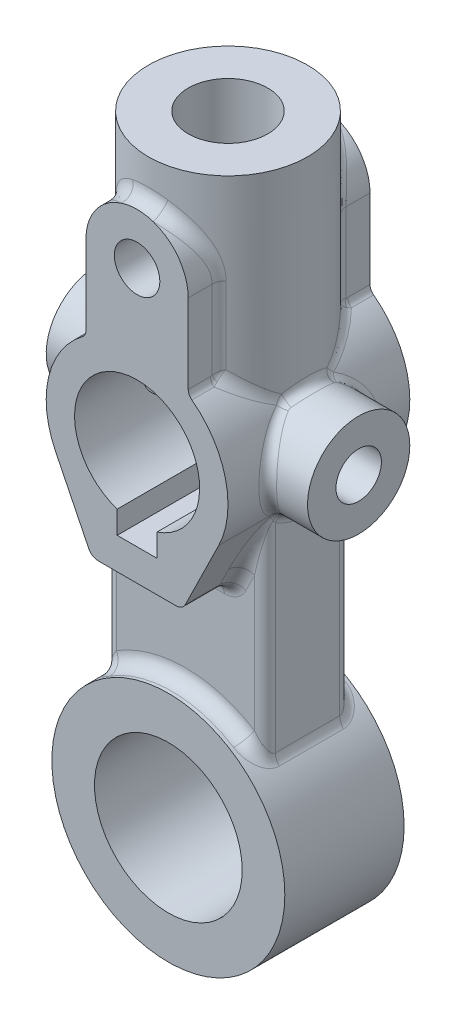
SolidWorks part; units mm, degrees
ref_plane "Front" through (0, 0, 0) normal (0, 0, 1) x (1, 0, 0)
ref_plane "Top" through (0, 0, 0) normal (0, 1, 0) x (1, 0, 0)
ref_plane "Right" through (0, 0, 0) normal (1, 0, 0) x (0, 0, -1)
sketch "Sketch1" plane through (0, 0, 0) normal (0, 0, 1) x (1, 0, 0)
  line L0 (0, 0) -> (0, 44.45) construction
  line L1 (14.2875, 21.0007) -> (14.2875, 44.45)
  line L2 (-14.2875, 21.0007) -> (-14.2875, 44.45)
  line L3 (-12.7, -31.75) -> (12.7, -31.75)
  line L4 (12.7, -31.75) -> (22.7967, -11.2013)
  line L5 (-12.7, -31.75) -> (-22.7967, -11.2013)
  line L6 (0, 0) -> (0, -31.75) construction
  arc A0 (22.7967, -11.2013) -> (14.2875, 21.0007) centre (0, 0) ccw
  arc A1 (-14.2875, 44.45) -> (14.2875, 44.45) centre (0, 44.45) cw
  arc A2 (-14.2875, 21.0007) -> (-22.7967, -11.2013) centre (0, 0) ccw
  dimension "D1" = 14.2875
  dimension "D2" = 44.45
  dimension "D3" = 50.8
  dimension "D4" = 31.75
  dimension "D5" = 25.4
extrude "Base-Extrude" add sketch "Sketch1" along normal mid plane 50.8
sketch "Sketch2" plane through (0, 0, 0) normal (0, 1, 0) x (1, 0, 0)
  circle A0 centre (0, 0) radius 22.225
  dimension "D1" = 44.45
extrude "Boss-Extrude1" add sketch "Sketch2" along normal blind 69.85
sketch "Sketch3" plane through (0, 0, 0) normal (0, 1, 0) x (1, 0, 0)
  line L0 (0, 0) -> (22.225, 0) construction
  line L1 (-22.225, 11.9062) -> (22.225, 11.9062)
  line L2 (-22.225, 11.9062) -> (-22.225, -11.9062)
  line L3 (-22.225, -11.9062) -> (22.225, -11.9062)
  line L4 (22.225, 11.9062) -> (22.225, -11.9062)
  circle A0 centre (0, 0) radius 22.225 construction
  dimension "D1" = 23.8125
extrude "Boss-Extrude2" add sketch "Sketch3" against normal blind 95.25
sketch "Sketch4" plane through (0, 0, 0) normal (0, 0, 1) x (1, 0, 0)
  line L0 (0, 69.85) -> (0, 21.0007) construction
  line L1 (-22.225, -95.25) -> (22.225, -95.25) construction
  circle A0 centre (0, -95.25) radius 32.5437
  dimension "D1" = 65.0875
extrude "Boss-Extrude3" add sketch "Sketch4" along normal mid plane 33.3375
sketch "Sketch5" plane through (0, 0, 0) normal (1, 0, 0) x (0, 0, -1)
  circle A0 centre (0, 0) radius 14.2875
  dimension "D1" = 28.575
extrude "Boss-Extrude4" add sketch "Sketch5" along normal mid plane 73.025
sketch "Sketch7" plane through (0, 0, 0) normal (0, 0, 1) x (1, 0, 0)
  line L0 (0, 0) -> (0, -22.9184) construction
  line L1 (0, 69.85) -> (0, 13.3293) construction
  line L2 (-5.5563, -22.9184) -> (5.5562, -22.9184)
  line L3 (5.5562, -22.9184) -> (5.5562, -16.5684)
  line L4 (-5.5563, -22.9184) -> (-5.5563, -16.5684)
  arc A0 (5.5562, -16.5684) -> (-5.5563, -16.5684) centre (0, 0) ccw
  dimension "D1" = 34.9504
  dimension "D2" = 11.1125
  dimension "D3" = 6.35
extrude "Cut-Extrude2" cut sketch "Sketch7" against normal through all and the other way through all
sketch "Sketch10" plane through (0, 0, 0) normal (0, 0, 1) x (1, 0, 0)
  line L0 (0, 69.85) -> (0, 13.3293) construction
  circle A0 centre (0, 44.45) radius 6.35
  arc A1 (14.2875, 44.45) -> (-14.2875, 44.45) centre (0, 44.45) ccw construction
  dimension "D1" = 12.7
extrude "Cut-Extrude5" cut sketch "Sketch10" against normal through all and the other way through all
sketch "Sketch6" plane through (0, 0, 0) normal (1, 0, 0) x (0, 0, -1)
  circle A0 centre (0, 0) radius 6.35
  dimension "D1" = 12.7
extrude "Cut-Extrude1" cut sketch "Sketch6" against normal through all and the other way through all
sketch "Sketch8" plane through (0, 69.85, 0) normal (0, 1, 0) x (-1, 0, 0)
  circle A0 centre (0, 0) radius 11.1125
  dimension "D1" = 22.225
extrude "Cut-Extrude3" cut sketch "Sketch8" against normal up to next
sketch "Sketch9" plane through (0, 0, 0) normal (0, 0, 1) x (1, 0, 0)
  circle A0 centre (0, -95.25) radius 20.6375
  dimension "D1" = 41.275
extrude "Cut-Extrude4" cut sketch "Sketch9" against normal through all and the other way through all
fillet "Rounds" radius 2.921 8 edges at (12.7, -31.75, 18.6531) (-12.7, -31.75, 18.6531) (12.7, -31.75, -18.6531) (-12.7, -31.75, -18.6531) (-22.225, -41.921, 11.9062) (22.225, -41.921, 11.9062) (22.225, -41.921, -11.9062) (-22.225, -41.921, -11.9062)
fillet "Fillets.1" radius 2.54 4 edges at (-14.2875, 21.0007, 21.212) (14.2875, 21.0007, 21.212) (14.2875, 21.0007, -21.212) (-14.2875, 21.0007, -21.212)
fillet "Fillets.2" radius 3.81 46 edges at (0, -62.7062, 11.9062) (16.4032, -24.2134, 11.9062) (0, -31.75, 11.9062) (-16.4032, -24.2134, 11.9062) (22.225, -12.3649, 8.0718) (22.225, -71.4772, 0) (0, -62.7062, -11.9062) (-16.4032, -24.2134, -11.9062) (0, -31.75, -11.9062) (16.4032, -24.2134, -11.9062) (-22.225, -12.3649, -8.0718) (-22.225, -71.4772, 0) (21.3695, -14.1061, 11.0507) (21.8238, -71.1084, 10.4627) (21.3695, -14.1061, -11.0507) (21.4863, -70.8075, -10.9269) (-21.3695, -14.1061, 11.0507) (-21.4863, -70.8075, 10.9269) (-21.3695, -14.1061, -11.0507) (-21.8238, -71.1084, -10.4627) (-12.425, -31.3084, -11.9062) (12.425, -31.3084, -11.9062) (-12.425, -31.3084, 11.9062) (12.425, -31.3084, 11.9062) (14.2875, 33.3771, -17.024) (-20.9563, 14.3525, -7.4017) (-14.2875, 33.3771, 17.024) (18.4937, 17.411, 12.3262) (-14.424, 21.4827, 16.9085) (-14.645, 21.0049, -16.7175) (14.424, 21.4827, -16.9085) (14.645, 21.0049, 16.7175) (14.2875, 33.3771, 17.024) (0.3586, 30.167, -22.2221) (-14.2875, 33.3771, -17.024) (0.3586, 58.733, 22.2221) (20.6956, 14.7259, -8.102) (-20.1, 15.529, 9.4837) (-22.2221, 14.283, -0.3586) (22.1493, 14.1695, -1.8326) (22.225, -12.3649, -8.0718) (-22.225, -12.3649, 8.0718) (22.4956, -11.8141, -8.0349) (24.9685, -4.6617, -13.5056) (-22.4956, -11.8141, 8.0349) (-24.9685, 4.6617, -13.5056)
fillet "Fillets.3" radius 2.4892 40 edges at (-22.225, -14.2875, 0) (-22.225, -13.2503, 7.1647) (-22.225, -13.2503, -7.1647) (22.7048, -11.3883, -8.6278) (20.644, -15.5824, -13.7448) (22.6155, -11.5702, -8.6838) (22.225, -14.2875, 0) (22.225, -13.2503, 7.1647) (22.225, -13.2503, -7.1647) (25.3998, 0.1076, -14.2871) (21.87, 12.9425, 6.0518) (21.8131, 13.5293, -4.5926) (22.237, -12.9487, 6.0386) (-22.6155, -11.5702, -8.6838) (-22.7048, -11.3883, 8.6278) (-22.2221, 14.283, -0.3586) (-25.3998, -0.1076, -14.2871) (-21.8131, 13.5293, 4.5926) (-21.8113, 13.1335, -5.6253) (-22.237, -12.9487, -6.0386) (-20.644, -15.5824, 13.7448) (-22.6155, -11.5702, 8.6838) (22.6155, -11.5702, 8.6838) (-19.8421, 17.6907, 10.0122) (19.8421, 17.6907, -10.0122) (-18.426, 17.4826, -15.1264) (-21.3695, -17.2626, -11.0507) (21.3695, -17.2626, 11.0507) (18.426, 17.4826, 15.1264) (-22.3239, -12.3879, -8.9853) (22.3239, -12.3879, -8.9853) (22.3239, -12.3879, 8.9853) (-22.3239, -12.3879, 8.9853) (25.3998, 0.1076, -14.2871) (22.7048, -11.3883, 8.6278) (-25.3998, -0.1076, -14.2871) (-22.7048, -11.3883, -8.6278)
